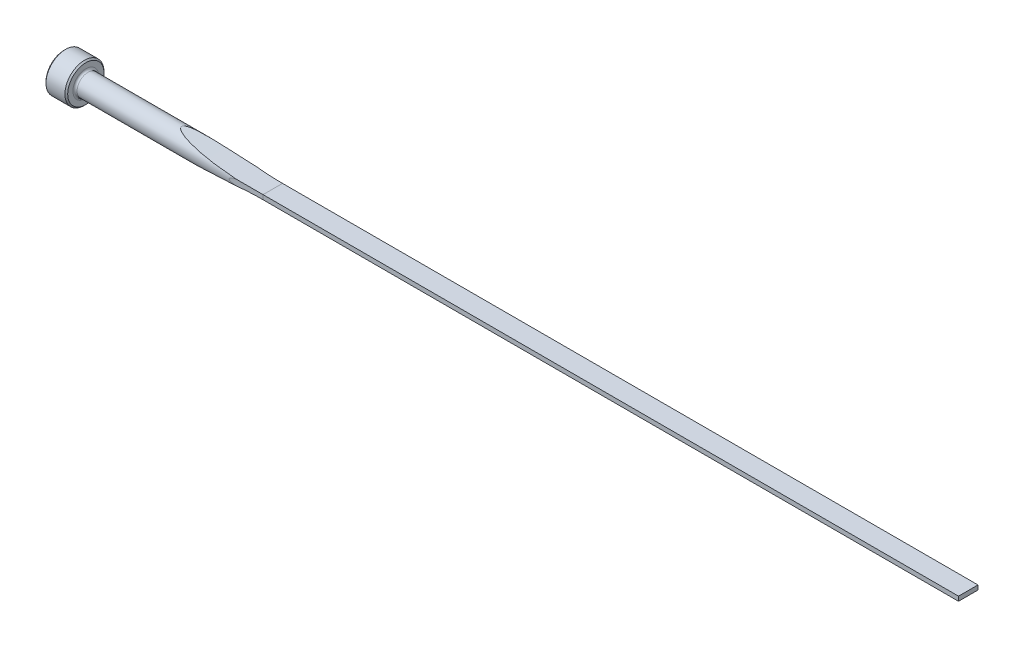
SolidWorks part; units mm, degrees
ref_plane "Front Plane" through (0, 0, 0) normal (0, 0, 1) x (1, 0, 0)
ref_plane "Top Plane" through (0, 0, 0) normal (0, 1, 0) x (1, 0, 0)
ref_plane "Right Plane" through (0, 0, 0) normal (1, 0, 0) x (0, 0, -1)
sketch "Sketch1" plane through (0, 0, 0) normal (0, 0, 1) x (1, 0, 0)
  line L0 (0, 0) -> (167.7268, 0) construction
  line L1 (0, 0) -> (0, 3.5687)
  line L2 (0, 3.5687) -> (3.9624, 3.5687)
  line L3 (3.9624, 3.5687) -> (3.9624, 1.9812)
  line L4 (3.9624, 1.9812) -> (165.1, 1.9812)
  line L5 (165.1, 1.9812) -> (165.1, 0)
  line L6 (165.1, 0) -> (0, 0)
  dimension "D1" = 165.1
  dimension "D2" = 7.1374
  dimension "D3" = 3.9624
  dimension "D4" = 3.9624
revolve "Revolve1" add sketch "Sketch1" angle 360 about L0
sketch "Sketch2" plane through (0, 0, 0) normal (0, 0, 1) x (1, 0, 0)
  line L0 (165.1, 1.9812) -> (165.1, 0.4064)
  line L1 (165.1, -1.9812) -> (165.1, 1.9812) construction
  line L2 (165.1, 0.4064) -> (38.1, 0.4064)
  line L3 (165.1, 1.9812) -> (3.9624, 1.9812) construction
  line L4 (21.4411, 1.9812) -> (165.1, 1.9812)
  line L5 (166.0833, 0) -> (153.1705, 0) construction
  arc A0 (38.1, 0.4064) -> (21.4411, 1.9812) centre (38.1, 89.3064) cw
  dimension "D1" = 88.9
  dimension "D3" = 127
  dimension "D2" = 0.8128
  dimension "D4" = 16.6589
extrude "Cut-Extrude1" cut sketch "Sketch2" against normal through all both and the other way through all
mirror "Mirror1" about plane through (0, 0, 0) normal (0, 1, 0) of "Cut-Extrude1"
sketch "Sketch3" plane through (0, 0, 0) normal (0, 1, 0) x (1, 0, 0)
  line L0 (165.1, 1.9812) -> (165.1, 1.778)
  line L1 (165.1, 1.9391) -> (165.1, -1.9391) construction
  line L2 (165.1, 1.778) -> (38.1, 1.778)
  line L3 (165.1, 1.9812) -> (3.9624, 1.9812) construction
  line L4 (32.0927, 1.9812) -> (165.1, 1.9812)
  line L5 (163.4716, 0) -> (166.2513, 0) construction
  line L6 (38.1, 1.9391) -> (38.1, -1.9391) construction
  arc A0 (38.1, 1.778) -> (32.0927, 1.9812) centre (38.1, 90.678) cw
  dimension "D2" = 88.9
  dimension "D1" = 3.556
extrude "Cut-Extrude2" cut sketch "Sketch3" against normal through all both and the other way through all
mirror "Mirror2" about plane through (0, 0, 0) normal (0, 0, 1) of "Cut-Extrude2"
fillet "Fillet1" radius 0.381 1 edges at (3.9624, 0, 1.9812)
chamfer "Chamfer1" distance 0.254 angle 45 2 edges at (0, 0, 3.5687) (3.9624, 0, 3.5687)
